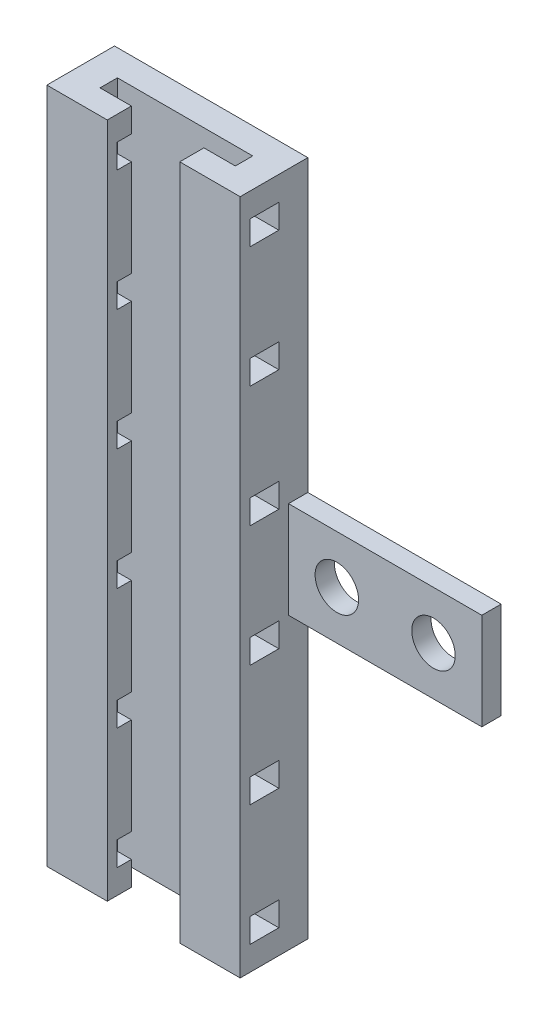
SolidWorks part; units mm, degrees
ref_plane "Front Plane" through (0, 0, 0) normal (0, 0, 1) x (1, 0, 0)
ref_plane "Top Plane" through (0, 0, 0) normal (0, 1, 0) x (1, 0, 0)
ref_plane "Right Plane" through (0, 0, 0) normal (1, 0, 0) x (0, 0, -1)
sketch "Sketch2" plane through (0, 0, 0) normal (0, 1, 0) x (1, 0, 0)
  line L0 (3, 2.5) -> (6.25, 2.5)
  line L2 (0, 0) -> (0, 7)
  line L3 (0, 7) -> (20, 7)
  line L4 (20, 0) -> (20, 7)
  line L6 (6.25, 0) -> (6.25, 2.5)
  line L8 (13.75, 0) -> (13.75, 2.5)
  line L9 (3, 4.3) -> (17, 4.3)
  line L10 (3, 4.3) -> (3, 2.5)
  line L12 (17, 4.3) -> (17, 2.5)
  line L14 (0, 0) -> (6.25, 0)
  line L15 (13.75, 0) -> (20, 0)
  line L16 (13.75, 2.5) -> (17, 2.5)
  dimension "D1" = 7
  dimension "D2" = 20
  dimension "D3" = 2.5
  dimension "D4" = 7.5
  dimension "D5" = 6.25
  dimension "D6" = 14
  dimension "D7" = 1.8
  dimension "D8" = 3
  dimension "D9" = 6.25
  dimension "D10" = 1.8
  dimension "D11" = 3.25
  dimension "D12" = 90
  dimension "D13" = 7.5
extrude "Boss-Extrude1" add sketch "Sketch2" along normal blind 70
sketch "Sketch3" plane through (20, 0, 0) normal (1, 0, 0) x (0, 0, -1)
  line L0 (7, 70) -> (7, 0) construction
  line L1 (7, 40) -> (5, 40)
  line L2 (7, 40) -> (7, 30)
  line L3 (7, 30) -> (5, 30)
  line L4 (5, 40) -> (5, 30)
  line L5 (0, 0) -> (7, 0) construction
  dimension "D1" = 10
  dimension "D2" = 2
  dimension "D3" = 30
extrude "Boss-Extrude2" add sketch "Sketch3" along normal blind 20
sketch "Sketch4" plane through (0, 0, -5) normal (0, 0, 1) x (1, 0, 0)
  line L0 (40, 40) -> (20, 40) construction
  line L1 (40, 30) -> (20, 30) construction
  line L2 (20, 70) -> (20, 0) construction
  circle A0 centre (25, 35) radius 2.25
  circle A1 centre (35, 35) radius 2.25
  dimension "D1" = 4.5
  dimension "D2" = 4.5
  dimension "D3" = 10
  dimension "D4" = 5
  dimension "D5" = 5
  dimension "D6" = 5
extrude "Cut-Extrude2" cut sketch "Sketch4" against normal blind 20 contours A0 | A1
sketch "Sketch5" plane through (20, 0, 0) normal (1, 0, 0) x (0, 0, -1)
  line L0 (0, 70) -> (0, 0) construction
  line L1 (1, 5) -> (4, 5)
  line L2 (1, 5) -> (1, 2.5)
  line L3 (1, 2.5) -> (4, 2.5)
  line L4 (4, 5) -> (4, 2.5)
  line L5 (0, 0) -> (7, 0) construction
  line L6 (1, 17.5) -> (1, 15)
  line L7 (1, 17.5) -> (4, 17.5)
  line L8 (4, 17.5) -> (4, 15)
  line L9 (1, 15) -> (4, 15)
  line L10 (1, 30) -> (1, 27.5)
  line L11 (1, 30) -> (4, 30)
  line L12 (4, 30) -> (4, 27.5)
  line L13 (1, 27.5) -> (4, 27.5)
  line L14 (1, 42.5) -> (1, 40)
  line L15 (1, 42.5) -> (4, 42.5)
  line L16 (4, 42.5) -> (4, 40)
  line L17 (1, 40) -> (4, 40)
  line L18 (1, 55) -> (1, 52.5)
  line L19 (1, 55) -> (4, 55)
  line L20 (4, 55) -> (4, 52.5)
  line L21 (1, 52.5) -> (4, 52.5)
  line L22 (1, 67.5) -> (1, 65)
  line L23 (1, 67.5) -> (4, 67.5)
  line L24 (4, 67.5) -> (4, 65)
  line L25 (1, 65) -> (4, 65)
  line L27 (0, 70) -> (7, 70) construction
  dimension "D1" = 3
  dimension "D2" = 2.5
  dimension "D3" = 1
  dimension "D4" = 2.5
  dimension "D6" = 2.5
  dimension "D5" = 6
extrude "Cut-Extrude3" cut sketch "Sketch5" against normal blind 39
